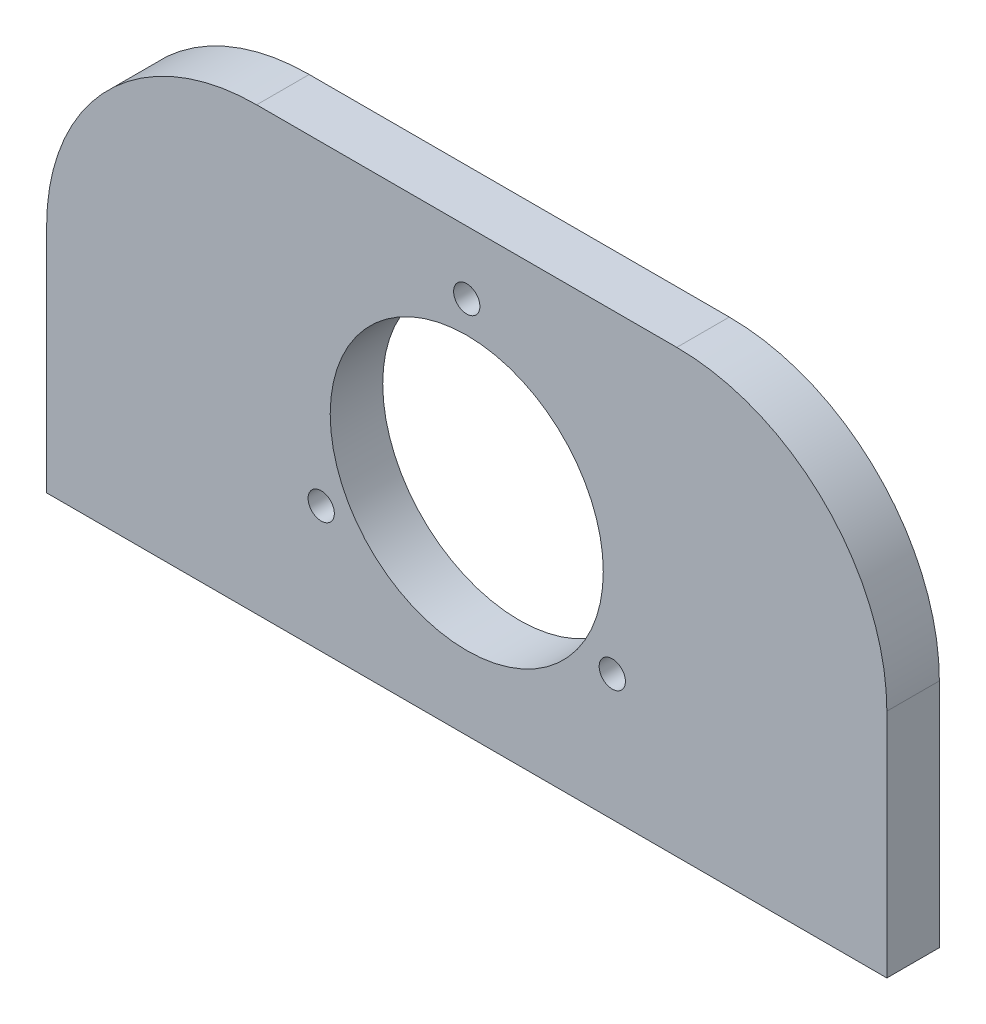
SolidWorks part; units mm, degrees
ref_plane "Front" through (0, 0, 0) normal (0, 0, 1) x (1, 0, 0)
ref_plane "Top" through (0, 0, 0) normal (0, 1, 0) x (1, 0, 0)
ref_plane "Right" through (0, 0, 0) normal (1, 0, 0) x (0, 0, -1)
sketch "Esquisse1" plane through (0, 0, 0) normal (0, 0, 1) x (1, 0, 0)
  line L0 (-40, 0) -> (40, 0) construction
  line L1 (0, 22) -> (0, -20) construction
  line L2 (-40, 22) -> (40, 22)
  line L3 (-40, 22) -> (-40, -20)
  line L4 (-40, -20) -> (40, -20)
  line L5 (40, 22) -> (40, -20)
  line L6 (-40, 15.2) -> (40, 15.2) construction
  circle A0 centre (0, 0) radius 13
  dimension "D1" = 80
  dimension "D2" = 20
  dimension "D4" = 26
  dimension "D3" = 22
  dimension "D5" = 15.2
extrude "Boss.-Extru.1" add sketch "Esquisse1" along normal mid plane 5
fillet "Congé1" radius 20 2 edges at (40, 22, 0) (-40, 22, 0)
hole_wizard "Diamètre du perçage Ø4.0 (4)1" positions "Esquisse2" profile "Esquisse3" hole size "Ø4.0" standard "ISO"
sketch "Esquisse2" plane through (0, -20, 0) normal (0, -1, 0) x (-1, 0, 0)
  line L0 (40, 0) -> (-40, 0) construction
  point P0 (-20, 0)
  point P4 (20, 0)
  dimension "D1" = 20
  dimension "D2" = 20
sketch "Esquisse3" plane through (20, -20, 0) normal (1, 0, 0) x (0, 0, -1)
  line L0 (0, 0) -> (0, 5.2017)
  line L1 (0, 5.2017) -> (2, 4)
  line L2 (2, 4) -> (2, 0)
  line L5 (2, 0) -> (0, 0)
  line L10 (0, 5.2017) -> (-2, 4) construction
  line L11 (0, -6.35) -> (0, 107.95) construction
  dimension "Diamètre du perçage" = 4
  dimension "Profondeur du perçage" = 4
  dimension "Angle de pointe" = 118
hole_wizard "Trou taraudé M41" positions "Esquisse6" profile "Esquisse7" tap size "M4" standard "ISO"
sketch "Esquisse6" plane through (0, -20, 0) normal (0, -1, 0) x (-1, 0, 0)
  line L0 (40, 0) -> (-40, 0) construction
  point P0 (-33.5, 0)
  point P4 (33.5, 0)
  dimension "D1" = 33.5
  dimension "D2" = 33.5
sketch "Esquisse7" plane through (33.5, -20, 0) normal (1, 0, 0) x (0, 0, -1)
  line L0 (0, 0) -> (0, 12.4914)
  line L1 (0, 12.4914) -> (1.65, 11.5)
  line L2 (1.65, 11.5) -> (1.65, 0)
  line L5 (1.65, 0) -> (0, 0)
  line L10 (0, 12.4914) -> (-1.65, 11.5) construction
  line L11 (0, -6.35) -> (0, 107.95) construction
  dimension "Diamètre du trou pour taraudage" = 3.3
  dimension "Profondeur du trou pour taraudage" = 11.5
  dimension "Angle de pointe" = 118
sketch "Esquisse8" plane through (0, 0, 2.5) normal (0, 0, 1) x (1, 0, 0)
  line L0 (0, 16) -> (0, 0) construction
  line L1 (0, 0) -> (13.8564, -8) construction
  line L2 (0, 0) -> (-13.8564, -8) construction
  circle A0 centre (0, 0) radius 16 construction
  dimension "D1" = 32
  dimension "D2" = 120
  dimension "D3" = 120
hole_wizard "Trou taraudé M31" positions "Esquisse9" profile "Esquisse10" tap size "M3" standard "ISO"
sketch "Esquisse9" plane through (0, 0, 2.5) normal (0, 0, 1) x (1, 0, 0)
  point P0 (13.8564, -8)
  point P3 (0, 16)
  point P6 (-13.8564, -8)
sketch "Esquisse10" plane through (13.8564, -8, 2.5) normal (1, 0, 0) x (0, -1, 0)
  line L0 (0, 0) -> (0, 5)
  line L1 (0, 5) -> (1.25, 5)
  line L2 (1.25, 5) -> (1.25, 0)
  line L5 (1.25, 0) -> (0, 0)
  line L11 (0, -6.35) -> (0, 107.95) construction
  dimension "Diamètre du trou pour taraudage jusqu'au prochain" = 2.5
  dimension "Profondeur du trou pour taraudage jusqu'au prochain" = 5
